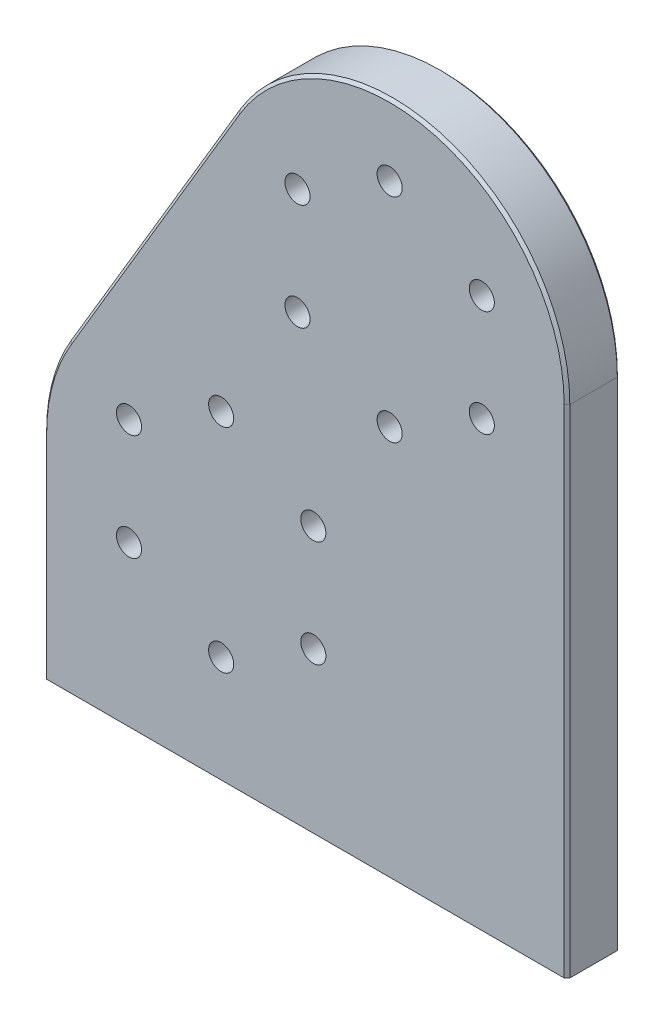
SolidWorks part; units mm, degrees
ref_plane "Front Plane" through (0, 0, 0) normal (0, 0, 1) x (1, 0, 0)
ref_plane "Top Plane" through (0, 0, 0) normal (0, 1, 0) x (1, 0, 0)
ref_plane "Right Plane" through (0, 0, 0) normal (1, 0, 0) x (0, 0, -1)
sketch "Sketch1" plane through (0, 0, 0) normal (0, 0, 1) x (1, 0, 0)
  line L0 (-27.3004, 54.3096) -> (2.8621, 105.1096)
  line L2 (-31.75, 38.1) -> (-31.75, 0)
  line L3 (-31.75, 0) -> (61.9125, 0)
  line L4 (61.9125, 88.9) -> (61.9125, 0)
  line L6 (0, 0) -> (0, 112.872) construction
  line L7 (30.1625, 88.9) -> (30.1625, 106.3892) construction
  arc A2 (61.9125, 88.9) -> (2.8621, 105.1096) centre (30.1625, 88.9) ccw
  arc A3 (-27.3004, 54.3096) -> (-31.75, 38.1) centre (0, 38.1) ccw
  dimension "D6" = 30.1625
  dimension "D5" = 63.5
  dimension "D7" = 63.5
  dimension "D3" = 38.1
  dimension "D4" = 50.8
extrude "Extrude1" add sketch "Sketch1" along normal mid plane 9.525
hole_wizard "#8-32 Tapped Hole1" positions "Sketch3" profile "Sketch2" tap size "#8-32" standard "Ansi Inch"
sketch "Sketch3" plane through (0, 0, 0) normal (0, -1, 0) x (1, 0, 0)
  line L0 (0, 0) -> (0, 14.985) construction
  point P0 (25.4, 0)
  point P1 (-25.4, 0)
  dimension "D1" = 50.8
sketch "Sketch2" plane through (25.4, 0, 0) normal (1, 0, 0) x (0, 0, -1)
  line L0 (0, 0) -> (0, 21.2054)
  line L1 (0, 21.2054) -> (1.7272, 20.1676)
  line L2 (1.7272, 20.1676) -> (1.7272, 17.78)
  line L3 (1.7272, 17.78) -> (2.0828, 17.78)
  line L4 (2.0828, 17.78) -> (2.0828, 0)
  line L5 (2.0828, 0) -> (0, 0)
  line L10 (0, 21.2054) -> (-1.7272, 20.1676) construction
  line L11 (0, -6.35) -> (0, 107.95) construction
  dimension "Tap Drill Dia." = 3.4544
  dimension "Tap Drill Depth" = 20.1676
  dimension "Thread Major Dia." = 4.1656
  dimension "Thread Depth" = 17.78
  dimension "Drill Angle" = 118
hole_wizard "#8 Clearance Hole1" positions "Sketch5" profile "Sketch4" hole size "#8" standard "Ansi Inch"
sketch "Sketch5" plane through (0, 0, 4.7625) normal (0, 0, 1) x (1, 0, 0)
  line L0 (30.1625, 88.9) -> (49.2125, 88.9) construction
  line L1 (30.1625, 88.9) -> (46.6603, 98.425) construction
  line L2 (0, 38.1) -> (19.05, 38.1) construction
  line L3 (0, 38.1) -> (16.4978, 47.625) construction
  line L4 (0, 38.1) -> (0, 57.15) construction
  line L5 (30.1625, 88.9) -> (30.1625, 107.95) construction
  circle A0 centre (30.1625, 88.9) radius 19.05 construction
  circle A1 centre (0, 38.1) radius 19.05 construction
  arc A3 (-27.3004, 54.3096) -> (-31.75, 38.1) centre (0, 38.1) ccw construction
  arc A4 (61.9125, 88.9) -> (2.8621, 105.1096) centre (30.1625, 88.9) ccw construction
  point P0 (30.1625, 69.85)
  point P1 (13.6647, 79.375)
  point P3 (46.6603, 98.425)
  point P5 (30.1625, 107.95)
  point P7 (13.6647, 98.425)
  point P9 (46.6603, 79.375)
  point P11 (16.4978, 47.625)
  point P13 (16.4978, 28.575)
  point P15 (0, 57.15)
  point P17 (-16.4978, 28.575)
  point P19 (-16.4978, 47.625)
  point P21 (0, 19.05)
  dimension "D1" = 38.1
  dimension "D2" = 30
  dimension "D3" = 30
sketch "Sketch4" plane through (30.1625, 69.85, 4.7625) normal (1, 0, 0) x (0, -1, 0)
  line L0 (0, 0) -> (0, 9.525)
  line L1 (0, 9.525) -> (2.2479, 9.525)
  line L2 (2.2479, 9.525) -> (2.2479, 0)
  line L5 (2.2479, 0) -> (0, 0)
  line L11 (0, -6.35) -> (0, 107.95) construction
  dimension "Thru Hole Dia." = 4.4958
  dimension "Thru Hole Depth" = 9.525
sketch "Sketch6" plane through (0, 0, 0) normal (0, -1, 0) x (1, 0, 0)
  circle A0 centre (0, 0) radius 2.3813
  circle A1 centre (50.8, 0) radius 2.3812
  circle A2 centre (-25.4, 0) radius 2.0828 construction
  circle A3 centre (25.4, 0) radius 2.0828 construction
  dimension "D1" = 4.7625
  dimension "D2" = 25.4
  dimension "D3" = 25.4
extrude "Cut-Extrude1" cut sketch "Sketch6" against normal blind 12.7
chamfer "Chamfer1" distance 0.508 angle 45 10 edges at (61.9125, 44.45, 4.7625) (38.5671, 119.5174, 4.7625) (-12.2191, 79.7096, 4.7625) (-30.6174, 46.5046, 4.7625) (-31.75, 19.05, 4.7625) (61.9125, 44.45, -4.7625) (38.5671, 119.5174, -4.7625) (-12.2191, 79.7096, -4.7625) (-30.6174, 46.5046, -4.7625) (-31.75, 19.05, -4.7625)
